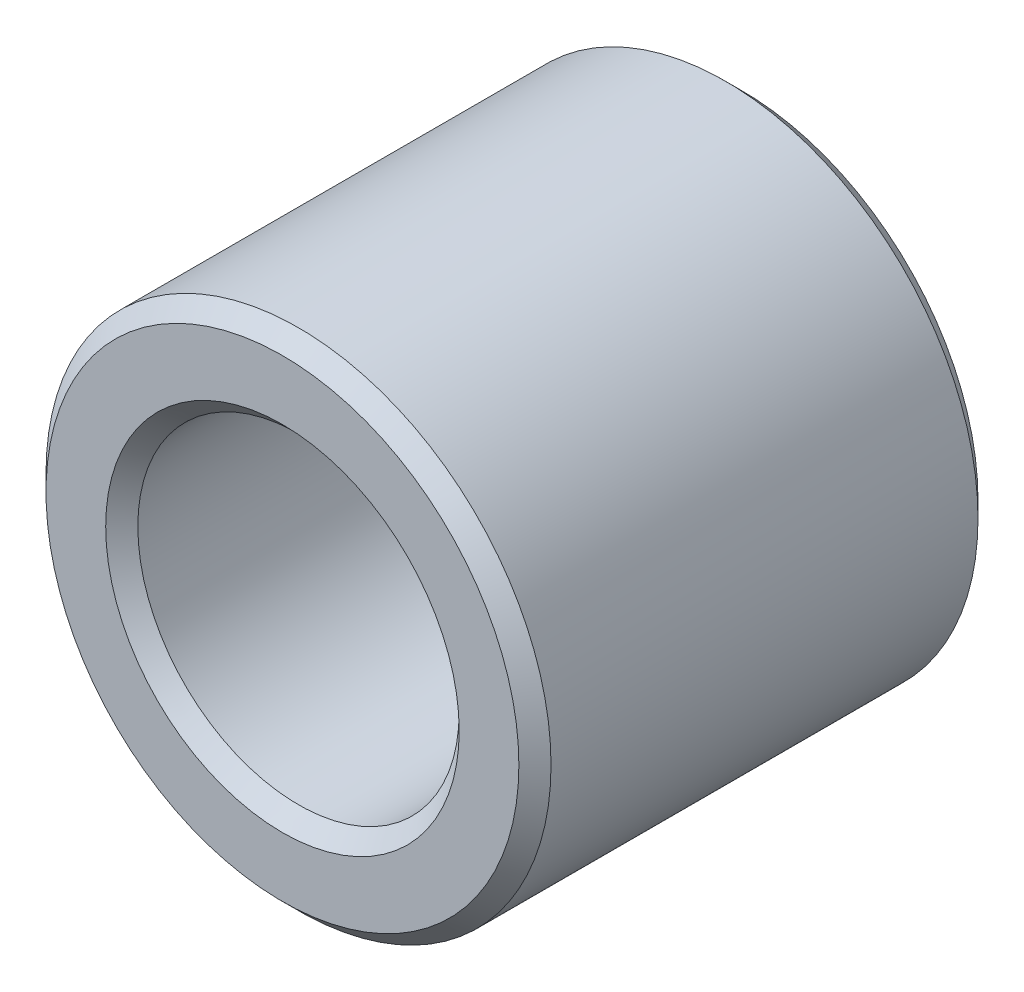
SolidWorks part; units mm, degrees
ref_plane "Front Plane" through (0, 0, 0) normal (0, 0, 1) x (1, 0, 0)
ref_plane "Top Plane" through (0, 0, 0) normal (0, 1, 0) x (1, 0, 0)
ref_plane "Right Plane" through (0, 0, 0) normal (1, 0, 0) x (0, 0, -1)
sketch "Sketch1" plane through (0, 0, 0) normal (0, 0, 1) x (1, 0, 0)
  circle A0 centre (0, 0) radius 35
  circle A1 centre (0, 0) radius 55
  dimension "D1" = 70
  dimension "D2" = 110
extrude "Boss-Extrude1" add sketch "Sketch1" along normal mid plane 100
chamfer "Chamfer1" distance 3.5 angle 45 4 edges at (35, 0, -50) (55, 0, -50) (35, 0, 50) (55, 0, 50)
